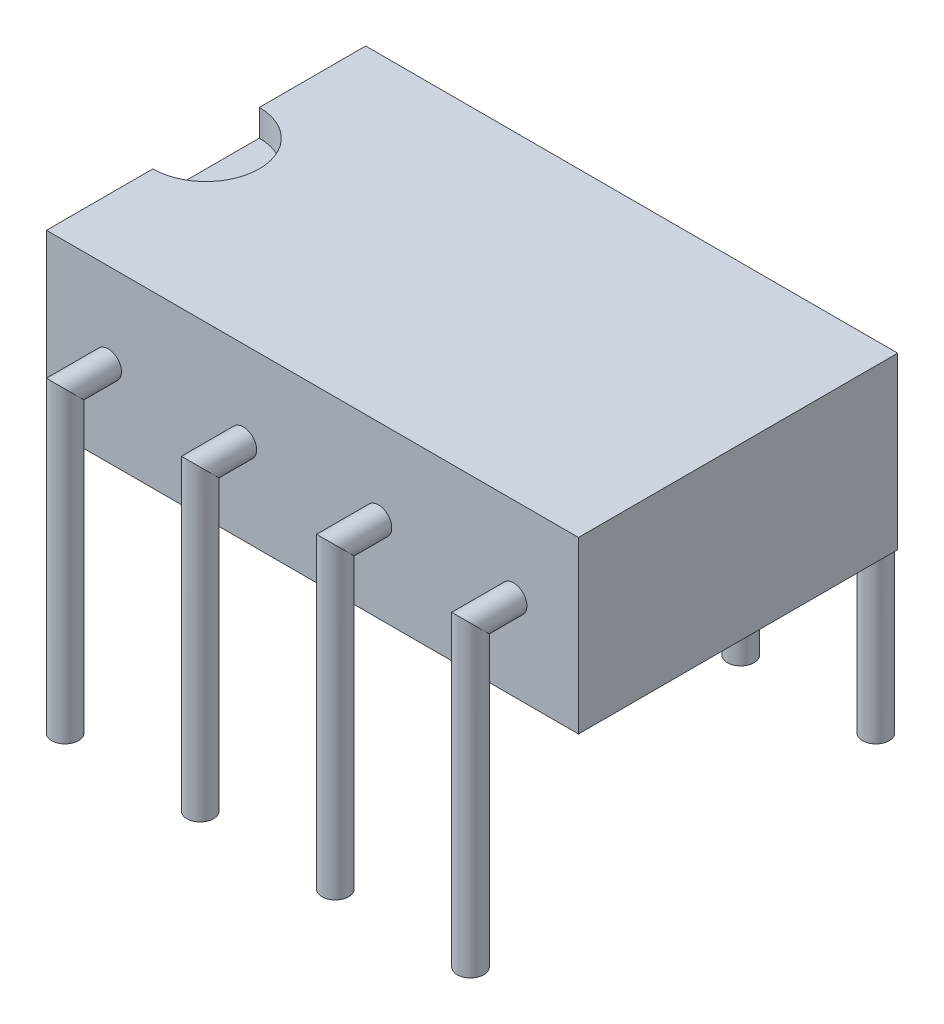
SolidWorks part; units mm, degrees
ref_plane "Plan de face" through (0, 0, 0) normal (0, 0, 1) x (1, 0, 0)
ref_plane "Plan de dessus" through (0, 0, 0) normal (0, 1, 0) x (1, 0, 0)
ref_plane "Plan de droite" through (0, 0, 0) normal (1, 0, 0) x (0, 0, -1)
sketch "Esquisse1" plane through (0, 0, 0) normal (1, 0, 0) x (0, 0, -1)
  line L0 (-34.0084, 0) -> (28.7946, 0) construction
  line L1 (0, -15.76) -> (0, 25.9507) construction
  line L2 (-13.1897, 3.2) -> (13.1184, 3.2) construction
  line L3 (3, 10.112) -> (3, -6.1718) construction
  line L4 (-3, 10.112) -> (-3, -4.99) construction
  line L6 (-3, 3.2) -> (3, 3.2)
  line L7 (-3, 3.2) -> (-3, 0)
  line L8 (-3, 0) -> (3, 0)
  line L9 (3, 3.2) -> (3, 0)
  dimension "D1" = 3
  dimension "D2" = 6
  dimension "D3" = 3.2
extrude "Extrusion1" add sketch "Esquisse1" along normal blind 10
sketch "Esquisse2" plane through (0, 3.2, 0) normal (0, 1, 0) x (-1, 0, 0)
  line L0 (0, -1) -> (0, 1)
  arc A0 (0, 1) -> (0, -1) centre (0, 0) ccw
extrude "Enlèv. mat.-Extru.1" cut sketch "Esquisse2" against normal blind 0.5
sketch "Esquisse3" plane through (0, 0, 3) normal (0, 0, 1) x (1, 0, 0)
  line L0 (-0.9705, 0) -> (10.7632, 0) construction
  line L1 (0, 4.319) -> (0, -1.0907) construction
  line L2 (-0.7349, 1.6) -> (2.3847, 1.6) construction
  line L3 (1.16, 2.698) -> (1.16, -1.0907) construction
  circle A0 centre (1.16, 1.6) radius 0.25
  dimension "D1" = 1.6
  dimension "D2" = 1.16
ref_plane "Plan1" through (1.16, 0, 0) normal (1, 0, 0) x (0, 0, -1)
sketch "Esquisse5" plane through (1.16, 0, 0) normal (1, 0, 0) x (0, 0, -1)
  line L0 (-4.2866, 0) -> (4.976, 0) construction
  line L1 (-3, -1.7147) -> (-3, 5.2592) construction
  line L2 (-4.2866, -4) -> (4.976, -4) construction
  line L3 (-3.81, -4.4343) -> (-3.81, 4.8284) construction
  line L4 (-4.2866, 1.6) -> (-3, 1.6) construction
  line L5 (-3, 1.6) -> (-3.81, 1.6)
  line L6 (-3.81, 1.6) -> (-3.81, -4)
  dimension "D1" = 4
  dimension "D2" = 0.81
sweep "Balayage1" add profiles "Esquisse3" path "Esquisse5"
ref_plane "Plan2" through (0, 0, 0) normal (0, 0, 1) x (1, 0, 0)
mirror "Symétrie1" about plane through (0, 0, 0) normal (0, 0, 1) of "Balayage1"
pattern_linear "Répétition linéaire1" count 4 spacing 2.54 along (1, 0, 0) of "Balayage1", "Symétrie1"
